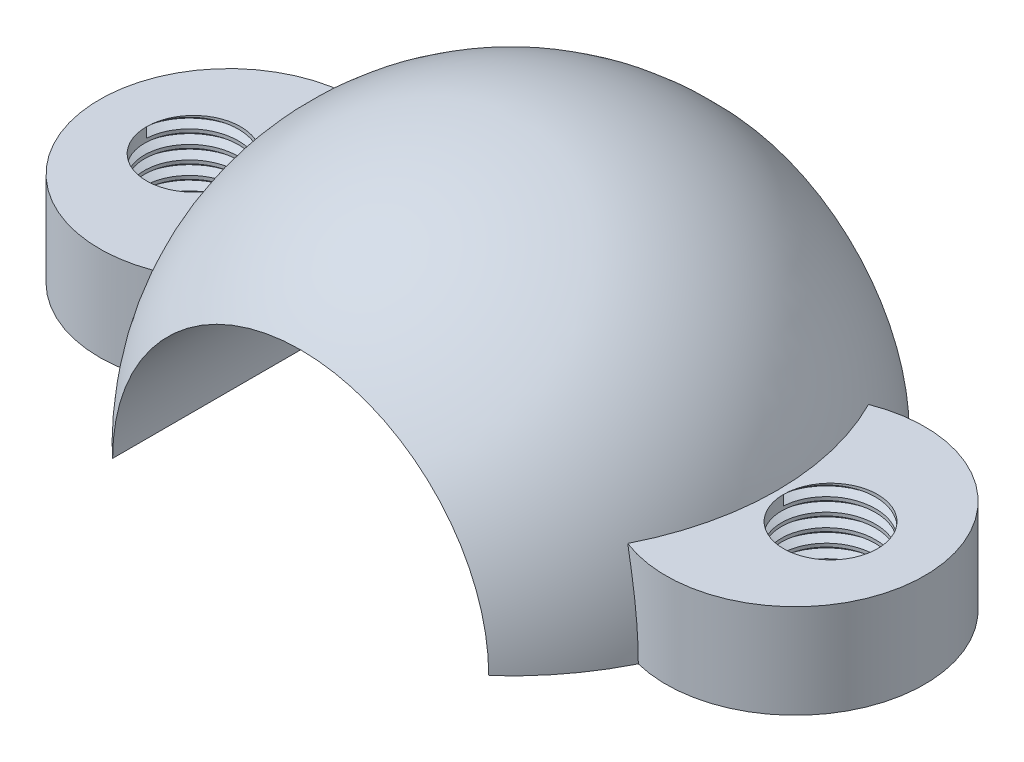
SolidWorks part; units mm, degrees
ref_plane "Front Plane" through (0, 0, 0) normal (0, 0, 1) x (1, 0, 0)
ref_plane "Bottom Plane" through (0, 0, 0) normal (0, 1, 0) x (1, 0, 0)
ref_plane "Right Plane" through (0, 0, 0) normal (1, 0, 0) x (0, 0, -1)
sketch "Sketch2" plane through (0, 0, 0) normal (0, 0, 1) x (1, 0, 0)
  line L0 (0, 19.05) -> (0, -19.05)
  arc A0 (0, 19.05) -> (0, -19.05) centre (0, 0) cw
  dimension "D1" = 19.05
  dimension "D2" = 38.1
revolve "Revolve1" add sketch "Sketch2" angle 360 about L0
sketch "Sketch4" plane through (0, 0, 0) normal (0, 0, 1) x (1, 0, 0)
  line L1 (-19.05, 0) -> (19.1115, 0)
  line L2 (-19.05, 0) -> (-19.05, -19.2599)
  line L3 (-19.05, -19.2599) -> (19.1115, -19.2599)
  line L4 (19.1115, 0) -> (19.1115, -19.2599)
  line L5 (-19.05, 0) -> (19.1115, -19.2599) construction
  line L6 (-19.05, -19.2599) -> (19.1115, 0) construction
  circle A0 centre (0, 0) radius 19.05 construction
  point P4 (0.0307, -9.63)
  dimension "D1" = 0.0307
  dimension "D2" = 9.63
extrude "Cut-Extrude2" cut sketch "Sketch4" along normal mid plane 38.1
sketch "Sketch5" plane through (0, 0, 0) normal (0, 1, 0) x (1, 0, 0)
  circle A0 centre (-19.05, 0) radius 8.7312
  circle A1 centre (0, 0) radius 19.05 construction
  circle A2 centre (19.2001, 0) radius 8.7313
  dimension "D1" = 17.4625
  dimension "D2" = 17.4625
  dimension "D3" = 19.2001
extrude "Boss-Extrude1" add sketch "Sketch5" along normal blind 6.35
sketch "Sketch3" plane through (0, 0, 0) normal (0, 0, 1) x (1, 0, 0)
  circle A0 centre (0, 0) radius 12.7
  dimension "D1" = 25.4
extrude "Cut-Extrude1" cut sketch "Sketch3" against normal mid plane 38.1
sketch "Sketch6" plane through (0, 0, 0) normal (0, 1, 0) x (1, 0, 0)
  line L0 (-27.7812, 0) -> (-21.4312, 0) construction
  line L1 (27.9313, 0) -> (21.5813, 0) construction
  line L2 (19.2001, 0) -> (23.9626, 0)
  line L3 (19.2001, 0) -> (19.2001, -8.7312)
  line L4 (19.2001, -8.7312) -> (23.9626, -8.7312)
  line L5 (23.9626, -8.7312) -> (23.9626, 0)
  arc A0 (-17.0491, 8.4989) -> (-17.0491, -8.4989) centre (-19.05, 0) ccw construction
  arc A2 (17.0653, -8.4663) -> (17.0653, 8.4663) centre (19.2001, 0) ccw construction
  circle A3 centre (-21.4312, 0) radius 3.175
  circle A4 centre (21.5813, 0) radius 3.175
  point P16 (21.5813, 0)
  dimension "D3" = 6.35
  dimension "D4" = 6.35
  dimension "D1" = 6.35
  dimension "D2" = 6.35
  dimension "D5" = 4.7625
extrude "Cut-Extrude3" cut sketch "Sketch6" along normal blind 10.16 contours A3 | A4
thread "Thread1" pitch 0.9071 start angle 0, offset 0, length 6.35, pitch 0.9071, diameter 6.35
ref_plane "Plane1" through (-24.6062, 6.35, 0) normal (0, 0, 1) x (-1, 0, 0)
sketch "Thread Profile1" plane through (-24.6062, 6.35, 0) normal (0, 0, 1) x (-1, 0, 0)
  line L0 (0, 0) -> (0, 0.9071) construction
  line L1 (0, 0) -> (0.491, 0.2835)
  line L2 (0.491, 0.2835) -> (0.491, 0.3969)
  line L3 (0.491, 0.3969) -> (0, 0.6804)
  line L4 (0.491, 0.3402) -> (0, 0.3402) construction
  line L11 (0, 0) -> (0, 0.6804)
  point P2 (0, 0)
  dimension "Pitch" = 0.9071
  dimension "Profile_Angle" = 60
  dimension "Profile_Land" = 0.1134
  dimension "Profile_Height" = 0.491
thread "Thread2" pitch 0.9071 start angle 0, offset 0, length 6.35, pitch 0.9071, diameter 6.35
ref_plane "Plane2" through (18.4063, 6.35, 0) normal (0, 0, 1) x (-1, 0, 0)
sketch "Thread Profile2" plane through (18.4063, 6.35, 0) normal (0, 0, 1) x (-1, 0, 0)
  line L0 (0, 0) -> (0, 0.9071) construction
  line L1 (0, 0) -> (0.491, 0.2835)
  line L2 (0.491, 0.2835) -> (0.491, 0.3969)
  line L3 (0.491, 0.3969) -> (0, 0.6804)
  line L4 (0.491, 0.3402) -> (0, 0.3402) construction
  line L11 (0, 0) -> (0, 0.6804)
  point P2 (0, 0)
  dimension "Pitch" = 0.9071
  dimension "Profile_Angle" = 60
  dimension "Profile_Land" = 0.1134
  dimension "Profile_Height" = 0.491
